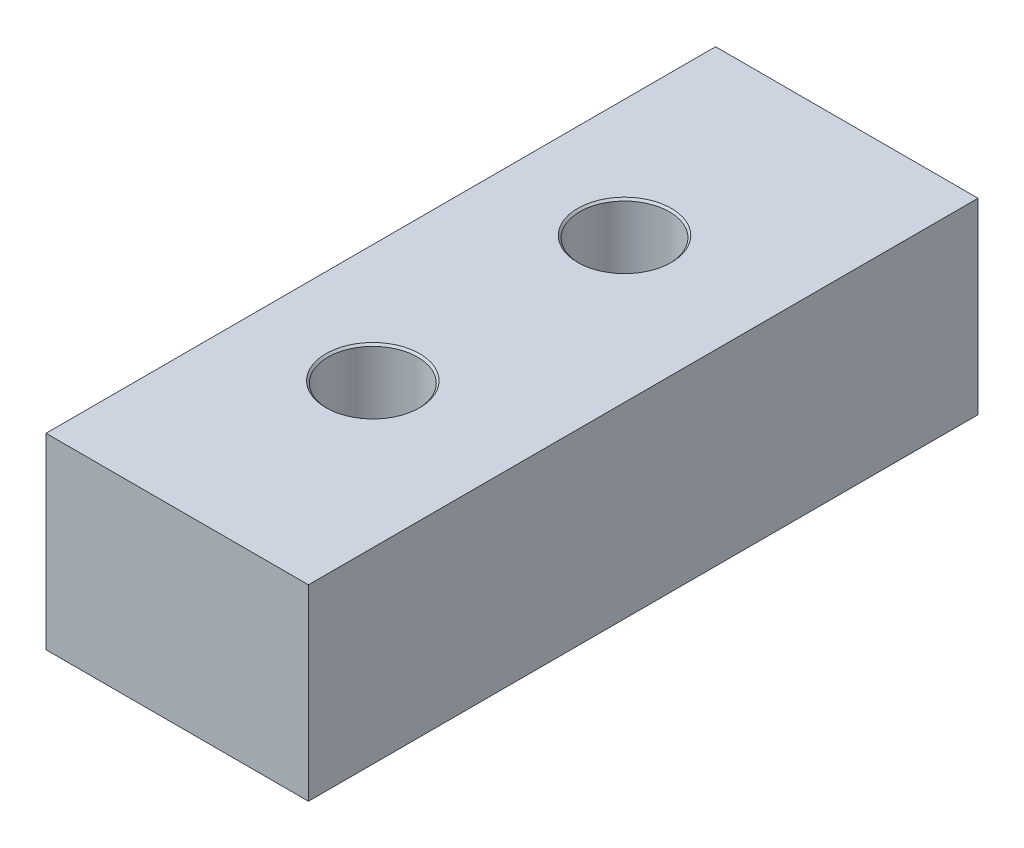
SolidWorks part; units mm, degrees
ref_plane "Front Plane" through (0, 0, 0) normal (0, 0, 1) x (1, 0, 0)
ref_plane "Top Plane" through (0, 0, 0) normal (0, 1, 0) x (1, 0, 0)
ref_plane "Right Plane" through (0, 0, 0) normal (1, 0, 0) x (0, 0, -1)
sketch "Sketch2" plane through (0, 0, 0) normal (0, 1, 0) x (1, 0, 0)
  line L1 (-24.5, -62.5) -> (24.5, -62.5)
  line L2 (-24.5, -62.5) -> (-24.5, 62.5)
  line L3 (-24.5, 62.5) -> (24.5, 62.5)
  line L4 (24.5, -62.5) -> (24.5, 62.5)
  line L5 (-24.5, -62.5) -> (24.5, 62.5) construction
  line L6 (-24.5, 62.5) -> (24.5, -62.5) construction
  point P0 (0, 0)
  dimension "D1" = 125
  dimension "D2" = 49
extrude "HUGE BLOCK " add sketch "Sketch2" along normal mid plane 35
sketch "HOLE LOCATIONS " plane through (0, 17.5, 0) normal (0, 1, 0) x (1, 0, 0)
  line L0 (-24.5, 0) -> (24.5, 0) construction
  line L1 (24.5, -62.5) -> (24.5, 62.5) construction
  line L2 (-24.5, 62.5) -> (-24.5, -62.5) construction
  line L3 (-2.4875, 23.495) -> (-2.4875, -23.495) construction
  line L4 (-14.1875, 23.5) -> (9.2125, -23.5) construction
  point P10 (-2.4875, 0)
  point P11 (-2.4875, 0)
  dimension "D1" = 46.99
  dimension "D2" = 26.9875
  dimension "D3" = 47
  dimension "D4" = 23.4
hole_wizard "Ø8.0(.3157)mm Dowel Hole1" positions "Sketch5" profile "Sketch4" hole size "Ø8.0" standard "ANSI Metric"
sketch "Sketch5" plane through (0, -17.5, 0) normal (0, 1, 0) x (-1, 0, 0)
  point P0 (14.1875, -23.5)
  point P3 (-9.2125, 23.5)
sketch "Sketch4" plane through (-14.1875, -17.5, -23.5) normal (1, 0, 0) x (0, 0, -1)
  line L0 (0, 0) -> (0, 6.858)
  line L1 (0, 6.858) -> (4.0094, 6.858)
  line L2 (4.0094, 6.858) -> (4.0094, 0.4906)
  line L3 (4.0094, 0.4906) -> (4.5, 0)
  line L5 (4.5, 0) -> (0, 0)
  line L6 (-4.0094, 0.4906) -> (-4.5, 0) construction
  line L10 (0, 6.858) -> (-4.0094, 6.858) construction
  line L11 (0, -6.35) -> (0, 107.95) construction
  dimension "Hole Dia." = 8.0188
  dimension "Hole Depth" = 6.858
  dimension "Near C'Sink Dia." = 9
  dimension "Near C'Sink Angle" = 90
  dimension "Drill Angle" = 180
hole_wizard "CBORE for M12 SHCS4" positions "Sketch17" profile "Sketch16" counterbore size "M12" standard "ANSI Metric"
sketch "Sketch17" plane through (0, 17.5, 0) normal (0, -1, 0) x (-1, 0, 0)
  point P0 (2.4875, 23.495)
  point P2 (2.4875, -23.495)
sketch "Sketch16" plane through (-2.4875, 17.5, -23.495) normal (1, 0, 0) x (0, 0, 1)
  line L0 (0, 0) -> (0, 35)
  line L1 (5.3594, 34.6094) -> (5.75, 35)
  line L2 (5.3594, 34.6094) -> (5.3594, 26.5526)
  line L3 (5.3594, 26.5526) -> (5.75, 26.162)
  line L4 (5.75, 26.162) -> (8.382, 26.162)
  line L5 (8.382, 26.162) -> (8.382, 0.368)
  line L6 (8.382, 0.368) -> (8.75, 0)
  line L7 (8.75, 0) -> (0, 0)
  line L8 (-8.382, 0.368) -> (-8.75, 0) construction
  line L9 (-5.3594, 26.5526) -> (-5.75, 26.162) construction
  line L11 (0, -6.35) -> (0, 107.95) construction
  line L12 (5.75, 35) -> (0, 35)
  line L13 (-5.3594, 34.6094) -> (-5.75, 35) construction
  dimension "Thru Hole Dia." = 10.7188
  dimension "Thru Hole Depth" = 35
  dimension "C'Bore Dia." = 16.764
  dimension "C'Bore Depth" = 26.162
  dimension "Near C'Sink Dia." = 17.5
  dimension "Near C'Sink Angle" = 90
  dimension "Mid C'Sink Dia." = 11.5
  dimension "Mid C'Sink Angle" = 90
  dimension "Far C'Sink Dia." = 11.5
  dimension "Far C'Sink Angle" = 90
